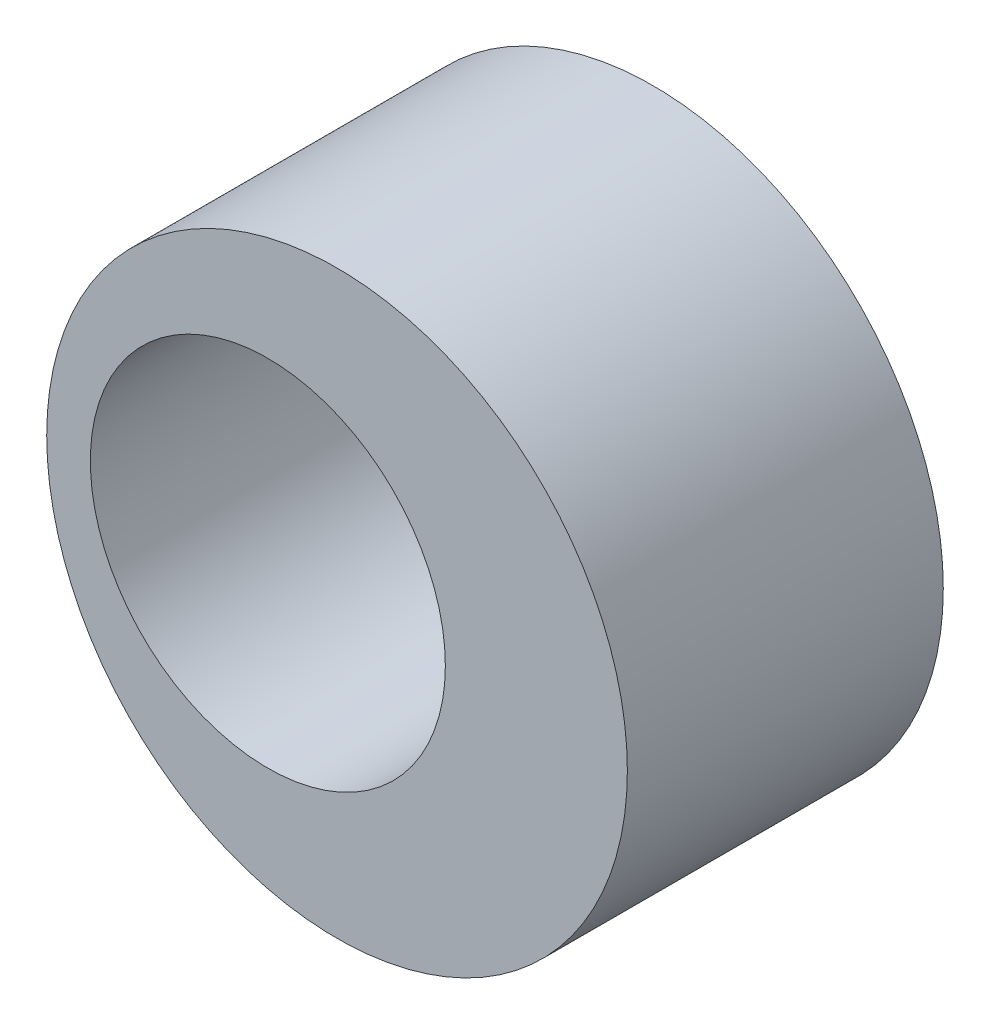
SolidWorks part; units mm, degrees
ref_plane "Front" through (0, 0, 0) normal (0, 0, 1) x (1, 0, 0)
ref_plane "Top" through (0, 0, 0) normal (0, 1, 0) x (1, 0, 0)
ref_plane "Right" through (0, 0, 0) normal (1, 0, 0) x (0, 0, -1)
sketch "Sketch1" plane through (0, 0, 0) normal (0, 0, 1) x (1, 0, 0)
  circle A0 centre (1.1684, 0) radius 4.9022
  dimension "D2" = 9.8044
  dimension "D1" = 1.1684
  dimension "D3" = 6.0706
  dimension "D4" = 3.7338
extrude "Extrude1" add sketch "Sketch1" along normal blind 5.715
sketch "Sketch2" plane through (0, 0, 0) normal (0, 0, -1) x (-1, 0, 0)
  circle A0 centre (0, 0) radius 6.985
  circle A1 centre (-1.1684, 0) radius 4.9022 construction
  dimension "D1" = 13.97
  dimension "D2" = 13.0556
extrude "Extrude2" [suppressed] add sketch "Sketch2" along normal blind 1.778
sketch "Sketch3" [suppressed] plane through (0, 0, -1.778) normal (0, 0, -1) x (-1, 0, 0)
  circle A0 centre (0, 0) radius 3
  dimension "D1" = 6
extrude "Cut-Extrude1" [suppressed] cut sketch "Sketch3" against normal through all
sketch "Sketch4" plane through (0, 0, 5.715) normal (0, 0, 1) x (1, 0, 0)
  circle A0 centre (0, 0) radius 2.9972
  dimension "D1" = 5.9944
extrude "Cut-Extrude2" cut sketch "Sketch4" against normal through all
sketch "Sketch6" plane through (0, 0, 0) normal (0, 0, -1) x (-1, 0, 0)
  circle A0 centre (0, 0) radius 3.556
  dimension "D1" = 7.112
extrude "Cut-Extrude4" cut sketch "Sketch6" against normal blind 0.381 flip side to cut
